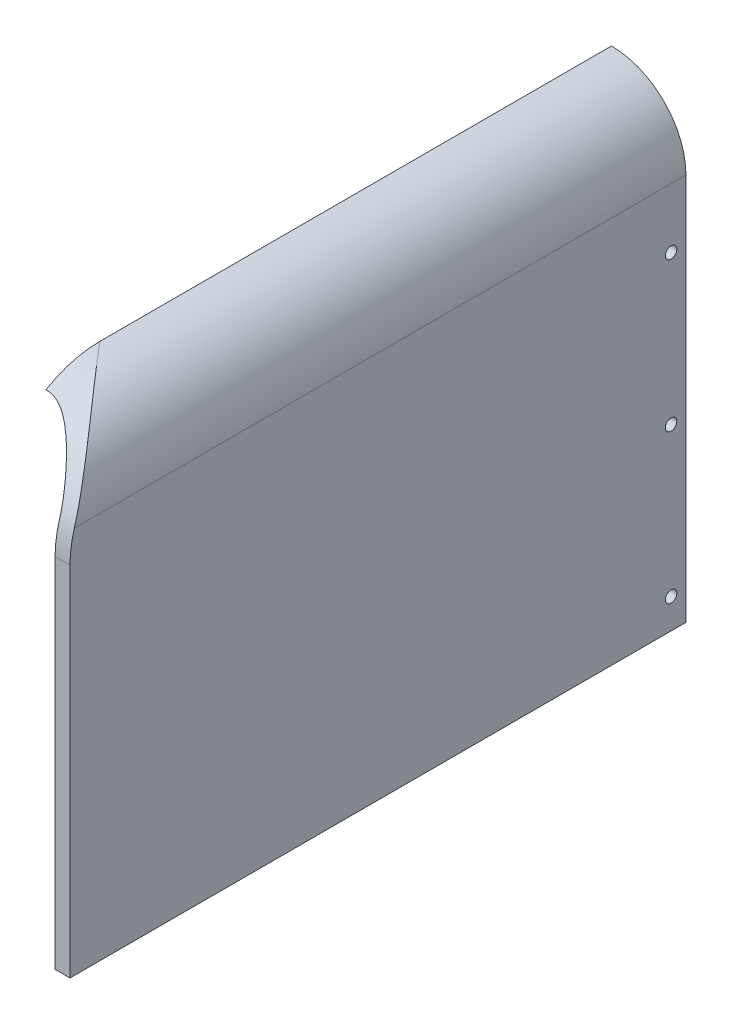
SolidWorks part; units mm, degrees
ref_plane "Front" through (0, 0, 0) normal (0, 0, 1) x (1, 0, 0)
ref_plane "Top" through (0, 0, 0) normal (0, 1, 0) x (1, 0, 0)
ref_plane "Right" through (0, 0, 0) normal (1, 0, 0) x (0, 0, -1)
sketch "Sketch1" plane through (0, 0, 0) normal (1, 0, 0) x (0, 0, -1)
  line L1 (0, 0) -> (525.018, 0)
  line L2 (0, 0) -> (0, 304.8)
  line L3 (0, 304.8) -> (525.018, 304.8)
  line L4 (525.018, 0) -> (525.018, 304.8)
  dimension "D1" = 525.018
  dimension "D2" = 304.8
extrude "Extrude1" add sketch "Sketch1" along normal blind 12.7
sketch "Sketch2" plane through (0, 0, 0) normal (-1, 0, 0) x (0, 0, 1)
  line L0 (-512.318, 304.8) -> (-512.318, 0) construction
  line L1 (-525.018, 304.8) -> (0, 304.8) construction
  line L2 (0, 0) -> (-525.018, 0) construction
  line L3 (-525.018, 0) -> (-525.018, 304.8) construction
  circle A0 centre (-512.318, 25.4) radius 4.9022
  circle A1 centre (-512.318, 279.4) radius 4.9022
  circle A2 centre (-512.318, 152.4) radius 4.9022
  dimension "D1" = 9.8044
  dimension "D4" = 25.4
  dimension "D5" = 152.4
  dimension "D2" = 12.7
  dimension "D3" = 25.4
extrude "Extrude2" cut sketch "Sketch2" against normal through all
fillet "Fillet1" [suppressed] radius 88.9
sketch "Sketch3" plane through (0, 0, -525.018) normal (0, 0, -1) x (-1, 0, 0)
  line L0 (-12.7, 0) -> (-12.7, 304.8) construction
  line L1 (0, 304.8) -> (-12.7, 304.8)
  line L2 (0, 304.8) -> (0, 330.2)
  line L4 (-12.7, 304.8) -> (-12.7, 330.2)
  line L5 (50.8, 381) -> (50.8, 393.7)
  arc A0 (50.8, 393.7) -> (-12.7, 330.2) centre (50.8, 330.2) ccw
  arc A1 (50.8, 381) -> (0, 330.2) centre (50.8, 330.2) ccw
  dimension "D2" = 127
  dimension "D1" = 25.4
extrude "Extrude3" add sketch "Sketch3" against normal up to surface (525.018 mm away)
sketch "Sketch4" plane through (12.7, 0, 0) normal (1, 0, 0) x (0, 0, -1)
  line L5 (0, 330.2) -> (0, 0) construction
  line L6 (0, 393.7) -> (525.018, 393.7) construction
  line L8 (0, 304.8) -> (-24.2247, 304.8)
  line L9 (88.9, 393.7) -> (88.9, 407.8265)
  line L10 (88.9, 407.8265) -> (-24.2247, 407.8265)
  line L11 (-24.2247, 304.8) -> (-24.2247, 407.8265)
  arc A1 (88.9, 393.7) -> (0, 304.8) centre (88.9, 304.8) ccw
  dimension "D1" = 177.8
extrude "Extrude4" cut sketch "Sketch4" against normal through all
